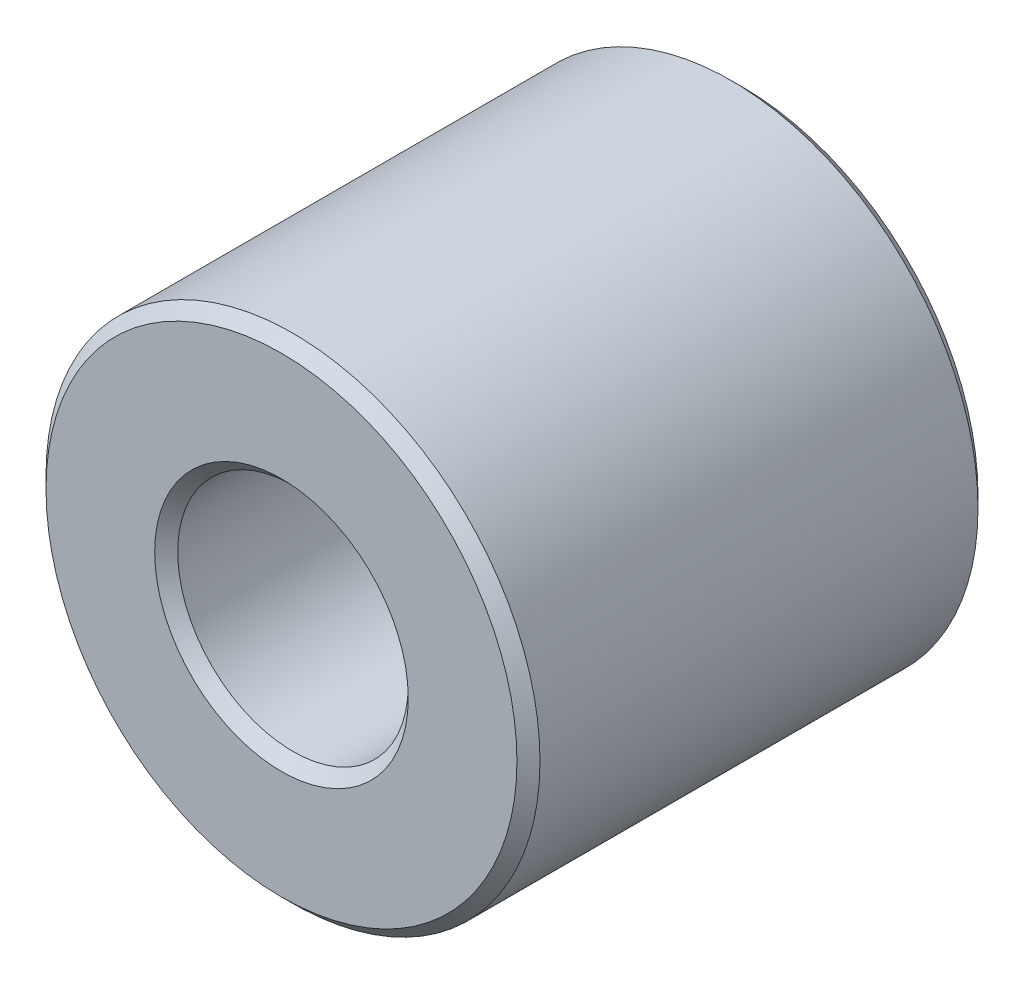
SolidWorks part; units mm, degrees
ref_plane "Front Plane" through (0, 0, 0) normal (0, 0, 1) x (1, 0, 0)
ref_plane "Top Plane" through (0, 0, 0) normal (0, 1, 0) x (1, 0, 0)
ref_plane "Right Plane" through (0, 0, 0) normal (1, 0, 0) x (0, 0, -1)
sketch "Sketch1" plane through (0, 0, 0) normal (0, 0, 1) x (1, 0, 0)
  circle A0 centre (0, 0) radius 14
  circle A1 centre (0, 0) radius 30
  dimension "D1" = 28
  dimension "D2" = 60
extrude "Boss-Extrude1" add sketch "Sketch1" along normal mid plane 56
chamfer "Chamfer1" distance 1.4 angle 45 4 edges at (14, 0, -28) (30, 0, -28) (14, 0, 28) (30, 0, 28)
